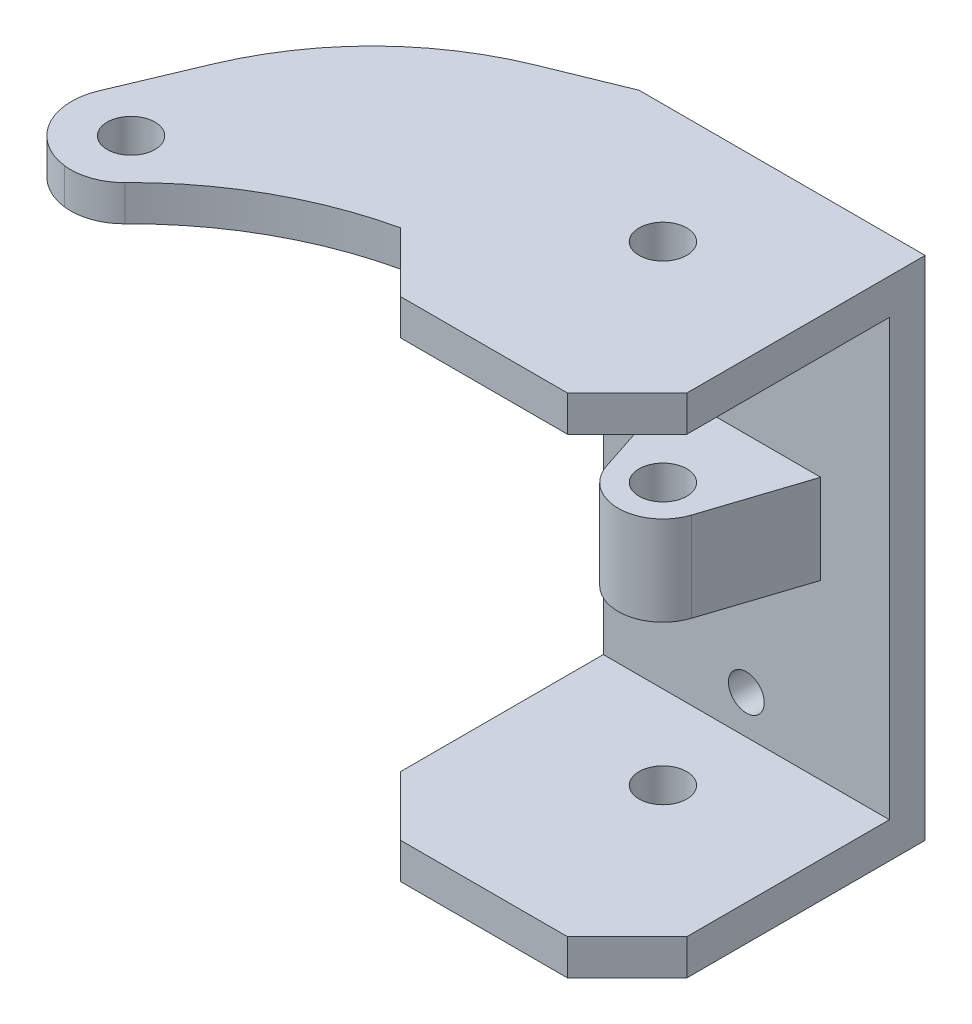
SolidWorks part; units mm, degrees
ref_plane "Ön Düzlem" through (0, 0, 0) normal (0, 0, 1) x (1, 0, 0)
ref_plane "Üst Düzlem" through (0, 0, 0) normal (0, 1, 0) x (1, 0, 0)
ref_plane "Sağ Düzlem" through (0, 0, 0) normal (1, 0, 0) x (0, 0, -1)
sketch "Çizim1" plane through (0, 0, 0) normal (0, 0, 1) x (1, 0, 0)
  line L0 (-24, 42.5) -> (24, 42.5)
  line L1 (-24, -42.5) -> (24, -42.5)
  line L2 (-24, -42.5) -> (-24, 42.5)
  line L4 (24, 42.5) -> (24, -42.5)
extrude "Yükseklik-Ekstrüzyon1" add sketch "Çizim1" along normal blind 6
sketch "Çizim2" plane through (0, 0, 6) normal (0, 0, 1) x (1, 0, 0)
  circle A0 centre (0, 30) radius 3
  circle A1 centre (0, -30) radius 3
  dimension "D1" = 30
  dimension "D2" = 30
extrude "Kes-Ekstrüzyon1" cut sketch "Çizim2" against normal blind 6
sketch "Çizim4" plane through (0, 0, 6) normal (0, 0, 1) x (1, 0, 0)
  line L0 (24, -42.5) -> (24, 42.5) construction
  line L1 (-24, 42.5) -> (24, 42.5)
  line L2 (-24, 42.5) -> (-24, 36.5)
  line L3 (-24, 36.5) -> (24, 36.5)
  line L4 (24, 42.5) -> (24, 36.5)
  line L6 (-24, -42.5) -> (24, -42.5)
  line L7 (-24, -42.5) -> (-24, -36.5)
  line L8 (-24, -36.5) -> (24, -36.5)
  line L9 (24, -42.5) -> (24, -36.5)
extrude "Yükseklik-Ekstrüzyon3" add sketch "Çizim4" along normal blind 44
chamfer "Pah1" distance 10 angle 45 4 edges at (-24, 39.5, 50) (24, 39.5, 50) (-24, -39.5, 50) (24, -39.5, 50)
sketch "Çizim5" plane through (0, 0, 0) normal (0, 1, 0) x (1, 0, 0)
  line L1 (-24, 0) -> (24, 0) construction
  line L2 (0, 0) -> (-14.9944, 0)
  line L3 (-14.9944, 0) -> (14.4258, 0)
  line L4 (14.4258, 0) -> (7.129, -22.3296)
  line L5 (-14.4258, 0) -> (-7.129, -22.3296)
  arc A0 (-7.129, -22.3296) -> (7.129, -22.3296) centre (0, -20) ccw
  dimension "D1" = 20
  dimension "D2" = 15
extrude "Yükseklik-Ekstrüzyon4" add sketch "Çizim5" along normal mid plane 15 contours L5 A0 L4 L3 L2
hole_wizard "Delik1" positions "Çizim8" profile "Çizim9" legacy
sketch "Çizim8" plane through (0, -7.5, 0) normal (0, -1, 0) x (-1, 0, 0)
  point P0 (0, -20)
sketch "Çizim9" plane through (0, -7.5, 20) normal (1, 0, 0) x (0, 0, -1)
  line L0 (0, 0) -> (0, 100)
  line L1 (0, 100) -> (4, 100)
  line L2 (4, 100) -> (4, 0)
  line L3 (4, 0) -> (0, 0)
  line L4 (0, 110) -> (0, -10) construction
  dimension "Diameter" = 8
  dimension "Depth" = 100
sketch "Çizim10" plane through (0, 42.5, 0) normal (0, 1, 0) x (1, 0, 0)
  circle A0 centre (0, -20) radius 4
extrude "Kes-Ekstrüzyon2" cut sketch "Çizim10" against normal blind 96
sketch "Çizim11" plane through (0, 42.5, 0) normal (0, 1, 0) x (1, 0, 0)
  line L1 (-24, 0) -> (-55.5144, -12.8311)
  line L2 (-55.5144, -12.8311) -> (-69.2177, -45.3562)
  line L4 (-24, -40) -> (-24, 0)
  arc A0 (-55.0022, -57.8991) -> (-69.2177, -45.3562) centre (-60.0022, -49.2388) cw
  circle A1 centre (-60.0022, -49.2388) radius 4
  arc A2 (-24, -40) -> (-55.0022, -57.8991) centre (-10.8671, -98.5451) ccw
  dimension "D3" = 10
  dimension "D1" = 135
extrude "Yükseklik-Ekstrüzyon5" add sketch "Çizim11" against normal blind 6
fillet "Radyus1" radius 50 1 edges at (-55.5144, 39.5, 12.8311)
fillet "Radyus2" radius 9 1 edges at (-55.0022, 39.5, 57.8991)
